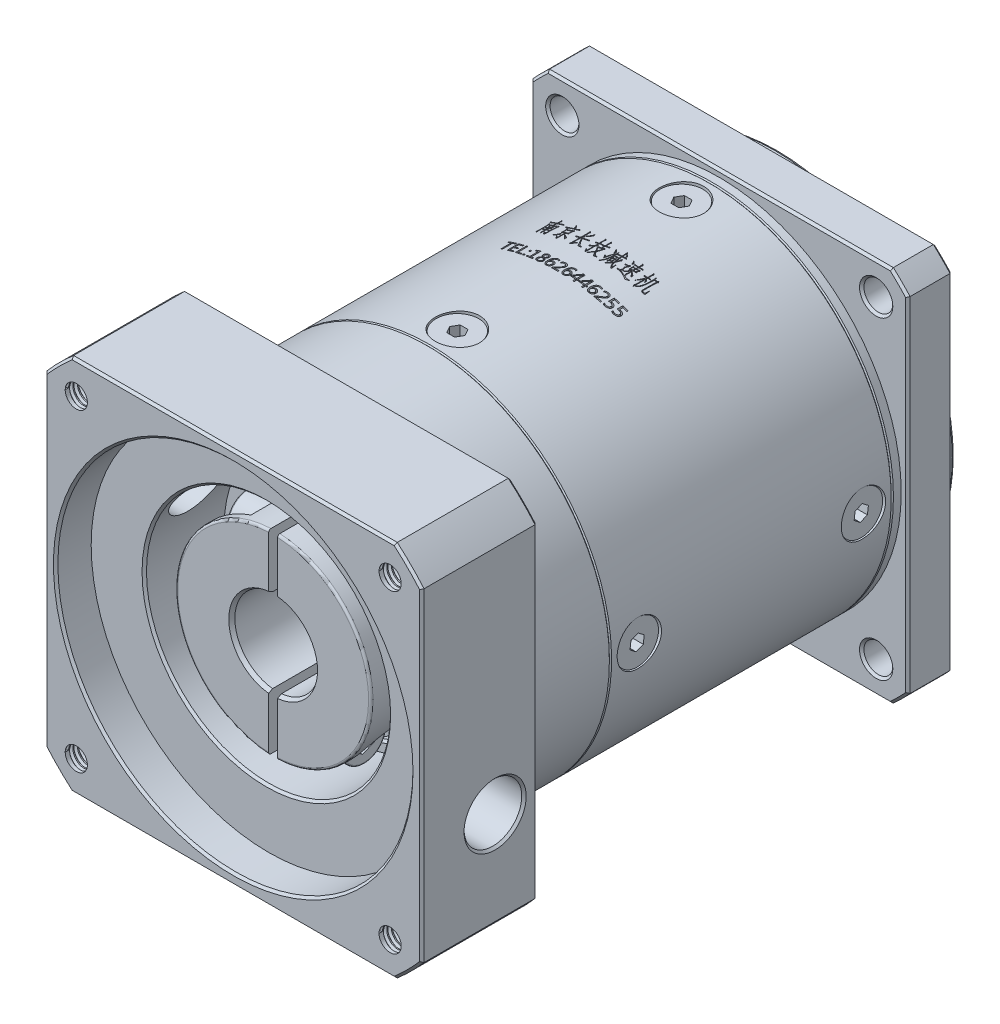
SolidWorks part; units mm, degrees
ref_plane "前视基准面" through (0, 0, 0) normal (0, 0, 1) x (1, 0, 0)
ref_plane "上视基准面" through (0, 0, 0) normal (0, 1, 0) x (1, 0, 0)
ref_plane "右视基准面" through (0, 0, 0) normal (1, 0, 0) x (0, 0, -1)
imported_body "19-80-100-M6-1-solid1"
imported_body "19-80-100-M6-1-solid2"
imported_body "19-80-100-M6-1-solid3"
imported_body "19-80-100-M6-1-solid4"
imported_body "ZF80-K15-L2-6-solid1"
imported_body "ZF80-K15-L2-6-solid2"
imported_body "ZF80-K15-L2-6-solid3"
imported_body "ZF80-K15-L2-6-solid4"
imported_body "ZF80-K15-L2-6-solid5"
imported_body "ZF80-K15-L2-6-solid6"
imported_body "ZF80-K15-L2-6-solid7"
imported_body "ZF80-K15-L2-6-solid8"
imported_body "ZF80-K15-L2-6-solid9"
sketch "草图1" plane through (0, 0, -61.2927) normal (0, 0, -1) x (-1, 0, 0)
  circle A0 centre (93.2642, 24.5962) radius 10.7526
  dimension "D1" = 21.5052
extrude "凸台-拉伸1" add sketch "草图1" along normal blind 5
